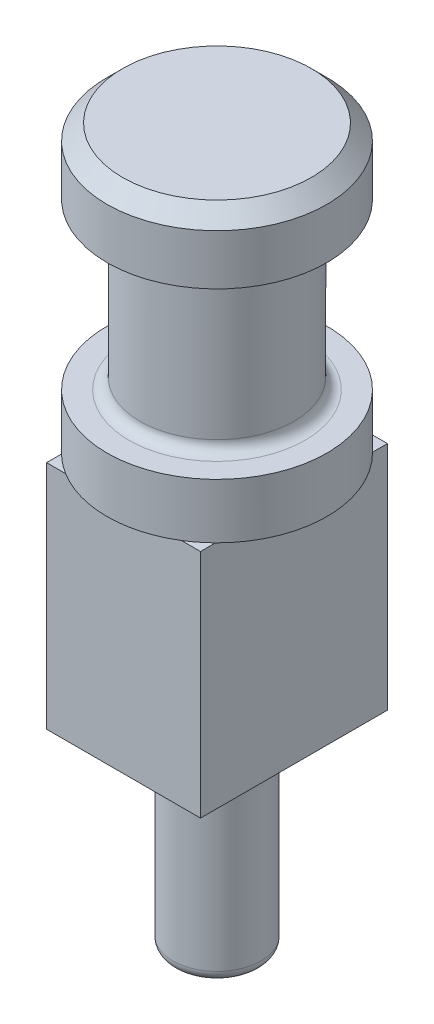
SolidWorks part; units mm, degrees
ref_plane "Front Plane" through (0, 0, 0) normal (0, 0, 1) x (1, 0, 0)
ref_plane "Top Plane" through (0, 0, 0) normal (0, 1, 0) x (1, 0, 0)
ref_plane "Right Plane" through (0, 0, 0) normal (1, 0, 0) x (0, 0, -1)
sketch "Sketch1" plane through (0, 0, 0) normal (0, 0, 1) x (1, 0, 0)
  line L0 (0, 45.9546) -> (0, -45.9546) construction
  line L1 (0, 45.9546) -> (8.5858, 45.9546)
  line L2 (8.5858, 45.9546) -> (10, 44.5404)
  line L3 (10, 44.5404) -> (10, 39.9546)
  line L4 (10, 39.9546) -> (7, 39.9546)
  line L5 (7, 39.9546) -> (7, 24.9546)
  line L6 (7, 24.9546) -> (10, 24.9546)
  line L7 (10, 24.9546) -> (10, 19.9546)
  line L8 (10, 19.9546) -> (7, 19.9546)
  line L9 (7, 19.9546) -> (7, -1.0454)
  line L10 (7, -1.0454) -> (4, -1.0454)
  line L11 (4, -1.0454) -> (4, -19.0454)
  line L12 (4, -19.0454) -> (0, -19.0454)
  line L13 (0, 45.9546) -> (0, -19.0454)
  point P15 (0, 23.0232)
  point P16 (0, 44.0259)
  point P17 (0, 33.6706)
  point P18 (0, 6.7274)
  point P19 (0, -22.0068)
  dimension "D1" = 2
  dimension "D2" = 10
  dimension "D3" = 7
  dimension "D4" = 225
  dimension "D5" = 15
  dimension "D6" = 10
  dimension "D7" = 5
  dimension "D8" = 21
  dimension "D9" = 39
  dimension "7" = 7
  dimension "D10" = 18
  dimension "D11" = 4
revolve "Revolve1" add sketch "Sketch1" angle 360 about L0
fillet "Fillet1" radius 1 1 edges at (0, -19.0454, 4)
fillet "Fillet2" radius 1 2 edges at (0, 24.9546, 7) (0, 39.9546, 7)
ref_plane "Plane1" through (0, 0, 8.5) normal (0, 0, 1) x (1, 0, 0)
sketch "Sketch2" plane through (0, 0, 8.5) normal (0, 0, 1) x (1, 0, 0)
  line L0 (7, 19.9546) -> (7, -1.0454)
  line L1 (-10, 19.9546) -> (10, 19.9546) construction
  line L2 (7, -1.0454) -> (-7, -1.0454)
  line L3 (-7, -1.0454) -> (-7, 19.9546)
  line L4 (-7, 19.9546) -> (7, 19.9546)
  line L5 (0, 19.9546) -> (0, -1.0454) construction
  dimension "D1" = 14
  dimension "D2" = 3
extrude "Boss-Extrude1" add sketch "Sketch2" against normal blind 17
